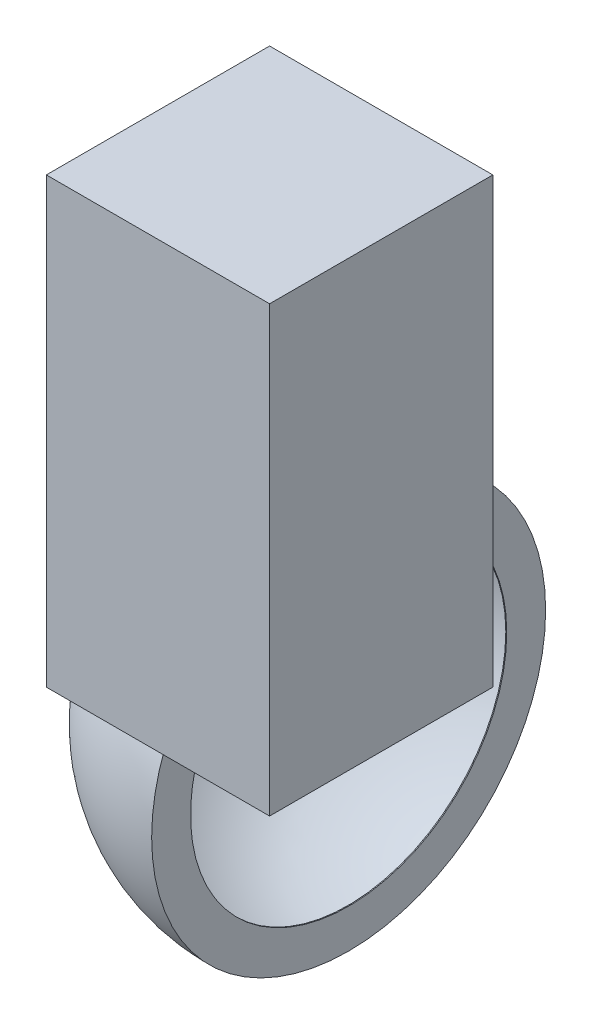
SolidWorks part; units mm, degrees
ref_plane "Front Plane" through (0, 0, 0) normal (0, 0, 1) x (1, 0, 0)
ref_plane "Top Plane" through (0, 0, 0) normal (0, 1, 0) x (1, 0, 0)
ref_plane "Right Plane" through (0, 0, 0) normal (1, 0, 0) x (0, 0, -1)
sketch "Sketch1" plane through (0, 0, 0) normal (0, 0, 1) x (1, 0, 0)
  line L0 (-326.5, 250) -> (-326.5, -250) construction
  line L1 (-326.5, 250) -> (-326.5, -250) construction
  line L2 (-326.5, 250) -> (-326.5, 310)
  line L3 (0, 0) -> (-739.0408, 0) construction
  arc A0 (-326.5, 310) -> (-636.5, 0) centre (-326.5, 0) ccw
  dimension "D1" = 310
revolve "Revolve-Thin1" add sketch "Sketch1" angle 360 about L3
sketch "Sketch2" plane through (0, 312.5, 0) normal (0, 1, 0) x (1, 0, 0)
  line L0 (-300, -500) -> (50, -500) construction
  line L1 (50, -150) -> (50, -500) construction
  line L2 (-300, -500) -> (-300, -150) construction
  line L3 (-300, -150) -> (50, -150) construction
  line L4 (-300, -500) -> (50, -500)
  line L5 (50, -150) -> (50, -500)
  line L6 (-300, -500) -> (-300, -150)
  line L7 (-300, -150) -> (50, -150)
extrude "Extrude-Thin1" add sketch "Sketch2" along normal blind 700 thin
sketch "Sketch3" plane through (0, 1012.5, 0) normal (0, 1, 0) x (1, 0, 0)
  line L4 (-301.5, -148.5) -> (-301.5, -501.5)
  line L5 (-301.5, -501.5) -> (51.5, -501.5)
  line L6 (51.5, -501.5) -> (51.5, -148.5)
  line L7 (51.5, -148.5) -> (-301.5, -148.5)
  line L8 (-301.5, -148.5) -> (-301.5, -501.5)
  line L9 (-301.5, -501.5) -> (51.5, -501.5)
  line L10 (51.5, -501.5) -> (51.5, -148.5)
  line L11 (51.5, -148.5) -> (-301.5, -148.5)
  dimension "D1" = 0
extrude "Extrude1" add sketch "Sketch3" along normal blind 1.5
